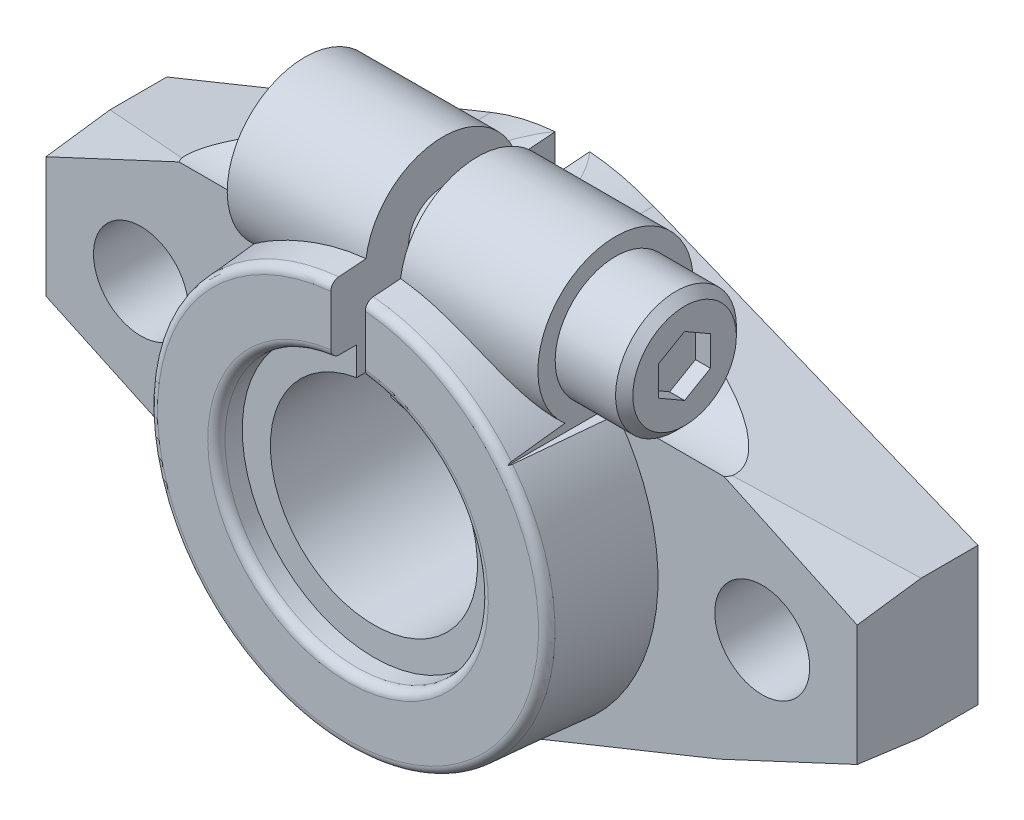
SolidWorks part; units mm, degrees
other "Solid1"
ref_plane "Front Plane" through (0, 0, 0) normal (0, 0, 1) x (1, 0, 0)
ref_plane "Top Plane" through (0, 0, 0) normal (0, 1, 0) x (1, 0, 0)
ref_plane "Right Plane" through (0, 0, 0) normal (1, 0, 0) x (0, 0, -1)
imported_body "2.7120 SHF12.stp<1>"
fillet "Fillet1" radius 0.5
